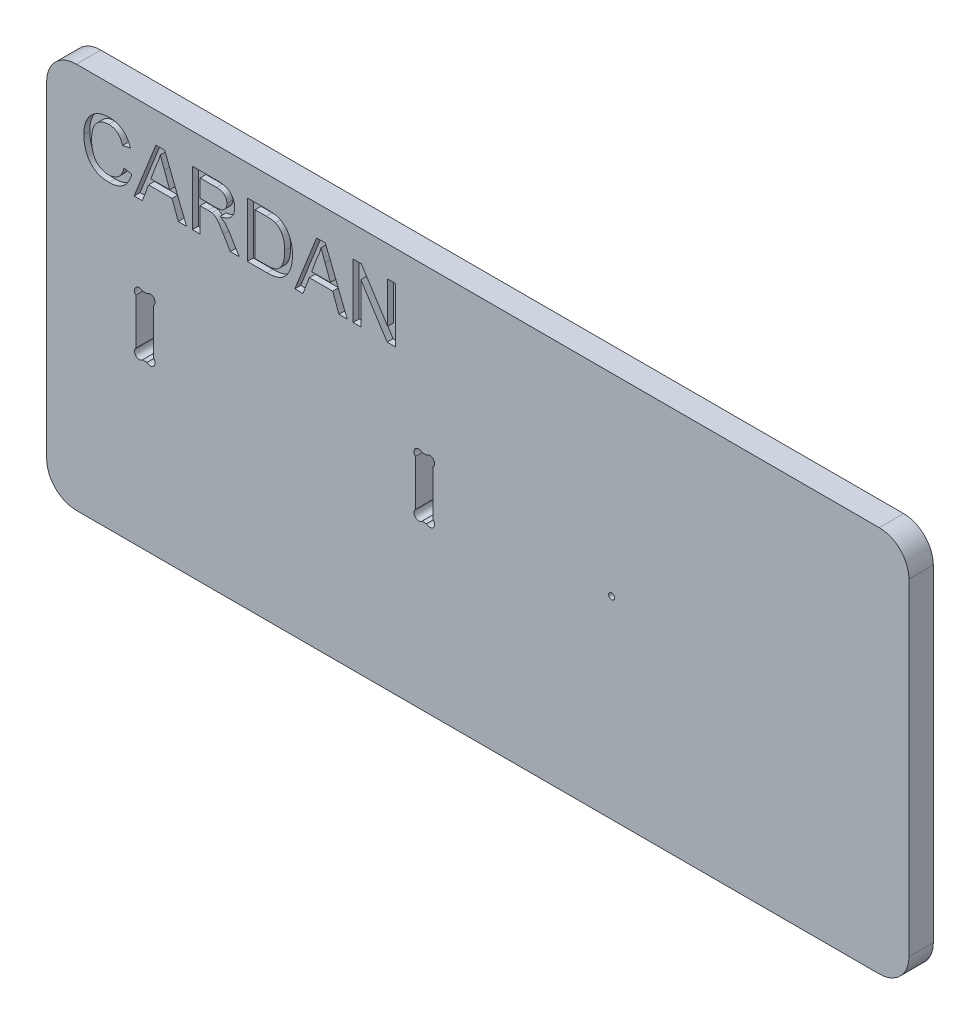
SolidWorks part; units mm, degrees
ref_plane "Plan de face" through (0, 0, 0) normal (0, 0, 1) x (1, 0, 0)
ref_plane "Plan de dessus" through (0, 0, 0) normal (0, 1, 0) x (1, 0, 0)
ref_plane "Plan de droite" through (0, 0, 0) normal (1, 0, 0) x (0, 0, -1)
sketch "Esquisse1" plane through (0, 0, 0) normal (0, 0, 1) x (1, 0, 0)
  line L0 (-25.9038, 100) -> (393.0673, 100) construction
  line L1 (0, -42.8766) -> (0, 225.4477) construction
  line L2 (-21.4102, 35) -> (315.179, 35) construction
  line L3 (-29.3483, 165) -> (344.3172, 165) construction
  line L4 (290, 197.6407) -> (290, -4.8109) construction
  line L6 (30, 61.411) -> (30, 143.779) construction
  line L7 (36, 67.4942) -> (36, 143.779) construction
  line L8 (21.6611, 110) -> (39.8066, 110) construction
  line L9 (80, 90) -> (80, 111.1788) construction
  line L10 (25.1807, 90) -> (40.0642, 90) construction
  line L11 (36, 110) -> (33.2222, 107.2222) construction
  line L12 (33, 102.3442) -> (33, 96.1122) construction
  line L13 (127.7373, 90) -> (126.2627, 90)
  line L14 (32.2627, 110) -> (33.7373, 110)
  line L15 (30, 107.7373) -> (30, 92.2627)
  line L16 (32.2627, 90) -> (33.7373, 90)
  line L17 (36, 107.7373) -> (36, 92.2627)
  line L18 (124, 107.7373) -> (124, 92.2627)
  line L19 (127.7373, 110) -> (126.2627, 110)
  line L20 (130, 107.7373) -> (130, 92.2627)
  line L21 (10, 165) -> (280, 165)
  line L22 (0, 155) -> (0, 45)
  line L23 (10, 35) -> (280, 35)
  line L24 (290, 155) -> (290, 45)
  arc A0 (10, 165) -> (0, 155) centre (10, 155) ccw
  arc A1 (280, 165) -> (290, 155) centre (280, 155) cw
  arc A2 (280, 35) -> (290, 45) centre (280, 45) ccw
  arc A3 (0, 45) -> (10, 35) centre (10, 45) ccw
  arc A4 (36, 107.7373) -> (33.7373, 110) centre (34.8686, 108.8686) ccw
  arc A5 (30, 107.7373) -> (32.2627, 110) centre (31.1314, 108.8686) cw
  arc A6 (30, 92.2627) -> (32.2627, 90) centre (31.1314, 91.1314) ccw
  arc A7 (36, 92.2627) -> (33.7373, 90) centre (34.8686, 91.1314) cw
  arc A8 (130, 92.2627) -> (127.7373, 90) centre (128.8686, 91.1314) cw
  arc A9 (124, 92.2627) -> (126.2627, 90) centre (125.1314, 91.1314) ccw
  arc A10 (124, 107.7373) -> (126.2627, 110) centre (125.1314, 108.8686) cw
  arc A11 (130, 107.7373) -> (127.7373, 110) centre (128.8686, 108.8686) ccw
  point P13 (0, 0)
  point P56 (0, 165)
  point P61 (290, 35)
  dimension "D1" = 65
  dimension "D3" = 10
  dimension "D2" = 45
extrude "Extrusion1" add sketch "Esquisse1" along normal blind 8.2
sketch "Esquisse2" plane through (0, 0, 8.2) normal (0, 0, 1) x (1, 0, 0)
  line L0 (-11.3135, 100) -> (395.2364, 100) construction
  line L1 (190, 218.5771) -> (190, -22.4999) construction
  circle A0 centre (190, 100) radius 1
  text T0 "CARDAN" font "Arial" height in points 72
extrude "Enlèv. mat.-Extru.1" cut sketch "Esquisse2" against normal blind 2
